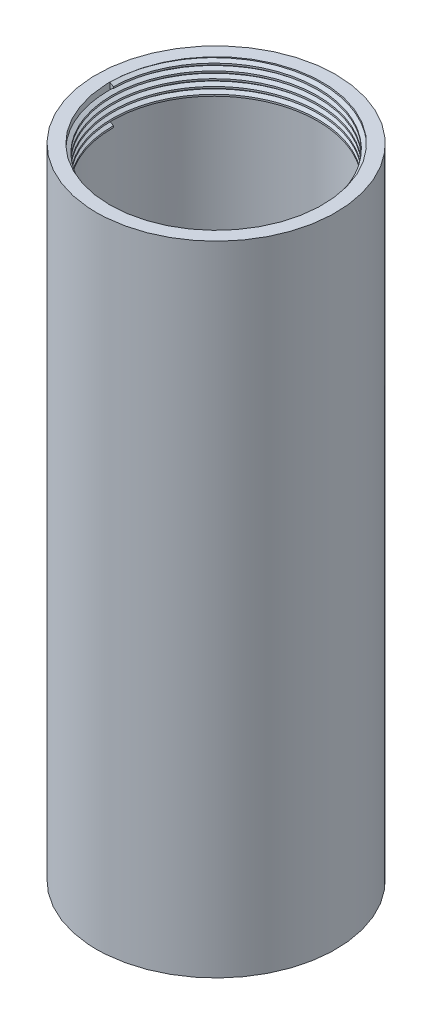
SolidWorks part; units mm, degrees
ref_plane "Front Plane" through (0, 0, 0) normal (0, 0, 1) x (1, 0, 0)
ref_plane "Top Plane" through (0, 0, 0) normal (0, 1, 0) x (1, 0, 0)
ref_plane "Right Plane" through (0, 0, 0) normal (1, 0, 0) x (0, 0, -1)
sketch "Sketch1" plane through (0, 0, 0) normal (0, 1, 0) x (1, 0, 0)
  circle A0 centre (0, 0) radius 90
  dimension "D1" = 180
extrude "Full Casing" add sketch "Sketch1" along normal blind 480
sketch "Sketch2" plane through (0, 0, 0) normal (0, -1, 0) x (1, 0, 0)
  circle A0 centre (0, 0) radius 80
  dimension "D1" = 160
extrude "Electronics Space" cut sketch "Sketch2" against normal blind 235
sketch "Sketch3" plane through (0, 480, 0) normal (0, 1, 0) x (1, 0, 0)
  circle A0 centre (0, 0) radius 80
  dimension "D1" = 160
extrude "Bladder Space" cut sketch "Sketch3" against normal blind 235 contours A0
thread "Thread1" pitch 5.08 start angle 0, offset 0, length 0, pitch 5.08, diameter 160
ref_plane "Plane1" through (-80, 480, 0) normal (0, 0, 1) x (-1, 0, 0)
sketch "Thread Profile1" plane through (-80, 480, 0) normal (0, 0, 1) x (-1, 0, 0)
  line L0 (0, 0) -> (0, 5.08) construction
  line L11 (0, 0) -> (0, 4.445)
  line L12 (0, 4.445) -> (-2.7496, 2.8575)
  line L13 (-2.7496, 2.8575) -> (-2.7496, 1.5875)
  line L15 (-2.7496, 1.5875) -> (0, 0)
  line L17 (-2.7496, 2.2225) -> (0, 2.2225) construction
  point P2 (0, 0)
  dimension "Pitch" = 5.08
  dimension "Profile_Angle" = 60
  dimension "Profile_Land" = 1.27
  dimension "Profile_Height" = 2.7496
thread "Thread2" pitch 5.08 start angle 0, offset 0, length 0, pitch 5.08, diameter 160
ref_plane "Plane2" through (80, 0, 0) normal (0, 0, 1) x (1, 0, 0)
sketch "Thread Profile2" plane through (80, 0, 0) normal (0, 0, 1) x (1, 0, 0)
  line L0 (0, 0) -> (0, 5.08) construction
  line L11 (0, 0) -> (0, 4.445)
  line L12 (0, 4.445) -> (-2.7496, 2.8575)
  line L13 (-2.7496, 2.8575) -> (-2.7496, 1.5875)
  line L15 (-2.7496, 1.5875) -> (0, 0)
  line L17 (-2.7496, 2.2225) -> (0, 2.2225) construction
  point P2 (0, 0)
  dimension "Pitch" = 5.08
  dimension "Profile_Angle" = 60
  dimension "Profile_Land" = 1.27
  dimension "Profile_Height" = 2.7496
